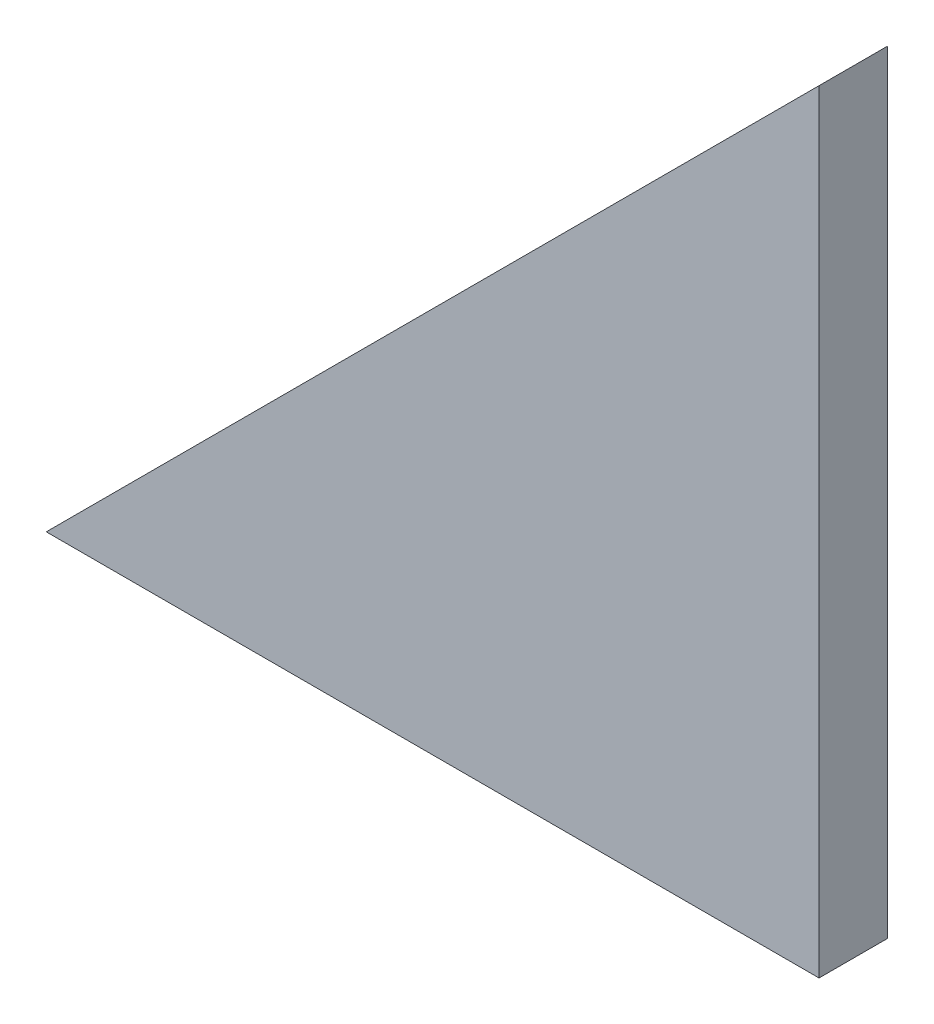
SolidWorks part; units mm, degrees
ref_plane "Przednia" through (0, 0, 0) normal (0, 0, 1) x (1, 0, 0)
ref_plane "Górna" through (0, 0, 0) normal (0, 1, 0) x (1, 0, 0)
ref_plane "Prawa" through (0, 0, 0) normal (1, 0, 0) x (0, 0, -1)
sketch "Szkic1" plane through (0, 0, 0) normal (0, 0, 1) x (1, 0, 0)
  line L0 (0, 0) -> (90, 0)
  line L1 (90, 0) -> (90, 90)
  line L2 (90, 90) -> (0, 0)
  dimension "D1" = 90
  dimension "D2" = 45
extrude "Dodanie-wyciągnięcie1" add sketch "Szkic1" along normal blind 8
hole_wizard "Otwór gwintowany M5x0.81" positions "Szkic3" profile "Szkic2" tap size "M5x0.8" standard "Ansi Metric"
sketch "Szkic3" plane through (0, 0, 0) normal (-0.7071, 0.7071, 0) x (0, 0, 1)
  line L0 (4, 0) -> (4, 35)
  line L1 (8, 0) -> (0, 0) construction
  line L2 (4, 35) -> (4, 110)
  point P0 (4, 35)
  point P2 (4, 110)
  dimension "D1" = 35
  dimension "D2" = 110
sketch "Szkic2" plane through (24.7487, 24.7487, 4) normal (0, 0, 1) x (-0.7071, -0.7071, 0)
  line L0 (0, 0) -> (0, 15.2618)
  line L1 (0, 15.2618) -> (2.1, 14)
  line L2 (2.1, 14) -> (2.1, 0)
  line L5 (2.1, 0) -> (0, 0)
  line L10 (0, 15.2618) -> (-2.1, 14) construction
  line L11 (0, -6.35) -> (0, 107.95) construction
  dimension "Średnica wiertła gwintu" = 4.2
  dimension "Głębokość otworu gwintowanego" = 14
  dimension "Kąt wiertła" = 118
hole_wizard "Otwór gwintowany M5x0.82" positions "Szkic5" profile "Szkic4" tap size "M5x0.8" standard "Ansi Metric"
sketch "Szkic5" plane through (0, 0, 0) normal (0, -1, 0) x (-1, 0, 0)
  line L0 (0, -4) -> (-25.5, -4)
  line L1 (0, -8) -> (0, 0) construction
  line L2 (-25.5, -4) -> (-55.5, -4)
  point P0 (-25.5, -4)
  point P2 (-55.5, -4)
  dimension "D1" = 30
  dimension "D2" = 25.5
sketch "Szkic4" plane through (25.5, 0, 4) normal (1, 0, 0) x (0, 0, -1)
  line L0 (0, 0) -> (0, 15.2618)
  line L1 (0, 15.2618) -> (2.1, 14)
  line L2 (2.1, 14) -> (2.1, 0)
  line L5 (2.1, 0) -> (0, 0)
  line L10 (0, 15.2618) -> (-2.1, 14) construction
  line L11 (0, -6.35) -> (0, 107.95) construction
  dimension "Średnica wiertła gwintu" = 4.2
  dimension "Głębokość otworu gwintowanego" = 14
  dimension "Kąt wiertła" = 118
